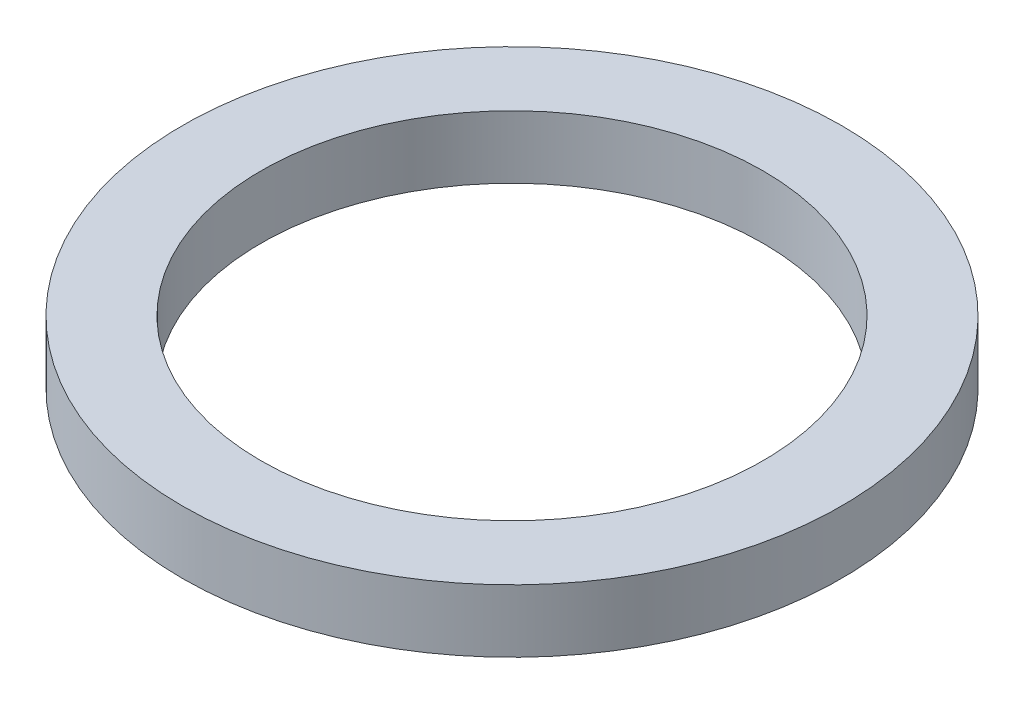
SolidWorks part; units mm, degrees
ref_plane "Face" through (0, 0, 0) normal (0, 0, 1) x (1, 0, 0)
ref_plane "Dessus" through (0, 0, 0) normal (0, 1, 0) x (1, 0, 0)
ref_plane "Droite" through (0, 0, 0) normal (1, 0, 0) x (0, 0, -1)
ref_plane "Plan4" through (0, 0.8, 0) normal (0, 1, 0) x (-1, 0, 0)
sketch "Esquisse1" plane through (0, 0.8, 0) normal (0, 1, 0) x (-1, 0, 0)
  circle A0 centre (-21.8, 0) radius 3.2
  circle A1 centre (-21.8, 0) radius 4.2
extrude "Base-Extrusion" add sketch "Esquisse1" against normal blind 0.8
